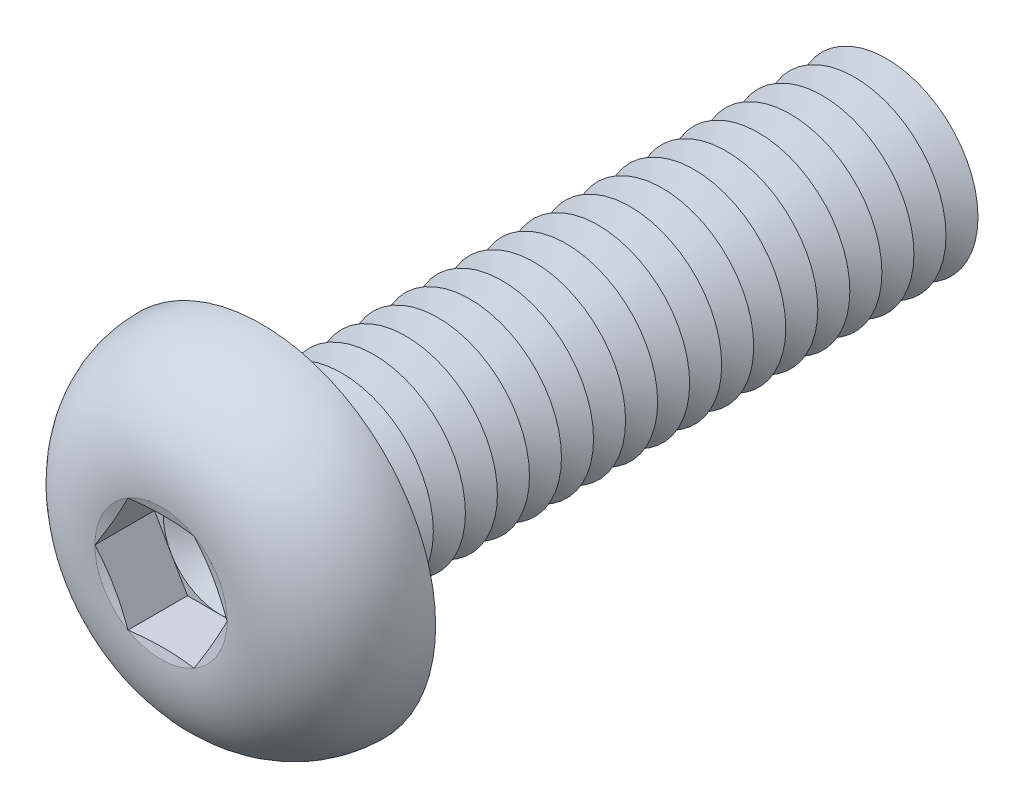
SolidWorks part; units mm, degrees
ref_plane "Front Plane" through (0, 0, 0) normal (0, 0, 1) x (1, 0, 0)
ref_plane "Top Plane" through (0, 0, 0) normal (0, 1, 0) x (1, 0, 0)
ref_plane "Right Plane" through (0, 0, 0) normal (1, 0, 0) x (0, 0, -1)
sketch "Sketch1" plane through (0, 0, 0) normal (1, 0, 0) x (0, 0, -1)
  line L0 (0, 2) -> (0, 3.8)
  line L3 (0, 2) -> (14, 2)
  line L4 (14, 2) -> (14, 0)
  line L5 (14, 0) -> (-2.2, 0) construction
  line L6 (-2.2, 0) -> (14, 0)
  line L7 (-2.2, 1.4434) -> (-2.2, 0.7217) construction
  line L8 (-2.2, 0.7217) -> (-2.2, 0)
  line L9 (-2.2, 1.4434) -> (-2.0066, 0.7217)
  line L10 (-2.0066, 0.7217) -> (-2.2, 0.7217)
  line L11 (14, 0) -> (22.7481, 0) construction
  line L12 (0, 3.8) -> (-2.2, 3.8) construction
  arc A1 (0, 3.8) -> (-2.2, 1.4434) centre (0, 1.5948) ccw
  point P8 (14, 1)
  dimension "D1" = 7.6
  dimension "D2" = 4
  dimension "D3" = 2.2
  dimension "D4" = 2.8868
  dimension "D5" = 14
  dimension "D6" = 15
revolve "Revolve1" add sketch "Sketch1" angle 360 about L5
fillet "Fillet1" radius 0.35 1 edges at (-2, 0, 0)
sketch "Sketch2" plane through (0, 0, 0) normal (1, 0, 0) x (0, 0, -1)
  line L0 (13.65, 2) -> (14.35, 2)
  line L1 (14, 2) -> (0.35, 2) construction
  line L2 (14.35, 2) -> (14, 1.3938)
  line L3 (14, -2) -> (14, 2) construction
  line L4 (14, 1.3938) -> (13.65, 2)
  dimension "D1" = 0.7
revolve "Cut-Revolve1" cut sketch "Sketch2" angle 360 about axis through (0, 0, -14) along (0, 0, -1)
pattern_linear "LPattern1" count 20 spacing 0.7 along (0, 0, 1) of "Cut-Revolve1"
sketch "Sketch3" plane through (0, 0, 2.2) normal (0, 0, 1) x (1, 0, 0)
  line L7 (0.7217, 1.25) -> (-0.7217, 1.25)
  line L8 (-0.7217, 1.25) -> (-1.4434, 0)
  line L9 (-1.4434, 0) -> (-0.7217, -1.25)
  line L10 (-0.7217, -1.25) -> (0.7217, -1.25)
  line L11 (0.7217, -1.25) -> (1.4434, 0)
  line L12 (1.4434, 0) -> (0.7217, 1.25)
  circle A0 centre (0, 0) radius 1.25 construction
  circle A3 centre (0, 0) radius 1.4434 construction
extrude "Cut-Extrude1" cut sketch "Sketch3" against normal blind 1.3
sketch "Sketch4" plane through (0, 0, 0.9) normal (0, 0, 1) x (1, 0, 0)
  line L1 (0.7217, 1.25) -> (-0.7217, 1.25) construction
  circle A0 centre (0, 0) radius 1.25
extrude "Cut-Extrude2" cut sketch "Sketch4" against normal through all draft 60
